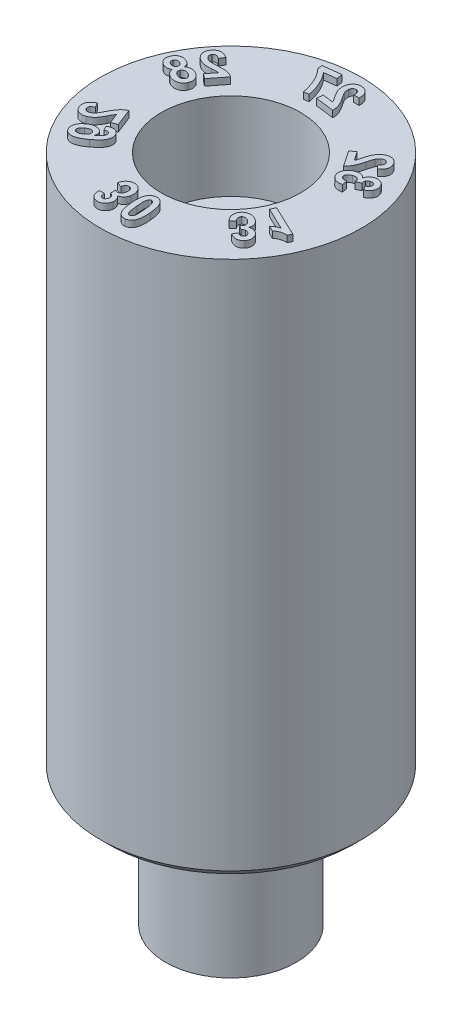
SolidWorks part; units mm, degrees
other "<M6L12-SetScrew>-<Chamfer1>" parameters "D10"=0.38
ref_plane "Front Plane" through (0, 0, 0) normal (0, 0, 1) x (1, 0, 0)
ref_plane "Top Plane" through (0, 0, 0) normal (0, 1, 0) x (1, 0, 0)
ref_plane "Right Plane" through (0, 0, 0) normal (1, 0, 0) x (0, 0, -1)
sketch "Sketch1" plane through (0, 0, 0) normal (0, 0, 1) x (1, 0, 0)
  line L0 (0, 0) -> (0, 20) construction
  line L1 (0, -6.6) -> (0, 6.6) construction
  line L2 (3, -24.7) -> (5.62, -24.7)
  line L4 (6, -24.32) -> (6, 0)
  line L5 (6, 0) -> (3.2, 0)
  line L6 (3.2, 0) -> (3.2, -4)
  line L7 (3.2, -4) -> (1.5, -4)
  line L8 (1.5, -4) -> (1.5, -16.7)
  line L9 (1.5, -16.7) -> (3, -16.7)
  line L10 (3, -16.7) -> (3, -24.7)
  line L11 (5.62, -24.7) -> (6, -24.32)
  point P6 (6, -24.7)
  dimension "D1" = 4
  dimension "D2" = 8
  dimension "D3" = 3
  dimension "D4" = 6.4
  dimension "D5" = 12
  dimension "D6" = 6
  dimension "D7" = 24.7
revolve "Revolve1" add sketch "Sketch1" angle 360 about L0
sketch "Sketch2" plane through (0, 0, 0) normal (0, 1, 0) x (1, 0, 0)
  line L0 (0, 0) -> (0, 4.1718) construction
  line L1 (0, 0) -> (3.6129, 2.0859) construction
  line L2 (0, 0) -> (3.6129, -2.0859) construction
  line L3 (0, 0) -> (0, -4.1718) construction
  line L4 (0, 0) -> (-3.6129, -2.0859) construction
  line L5 (0, 0) -> (-3.6129, 2.0859) construction
  arc A0 (0.9902, 3.7166) -> (2.0523, 3.253) centre (0, 0) ccw construction
  text T0 "27    28    29    30    31    32" font "Arial Narrow" height 1.55
  point P12 (0, 0)
  point P16 (0, 0)
  point P17 (0, 0)
  point P20 (0, 0)
  point P24 (0, 0)
  dimension "D1" = 3.8462
  dimension "D2" = 6
extrude "Boss-Extrude1" add sketch "Sketch2" along normal blind 0.3
inserted part "M6L12-SetScrew"
move or copy body "Body-Move/Copy2" placed by mates yes
other "Distance1" parameters "D1"=6
